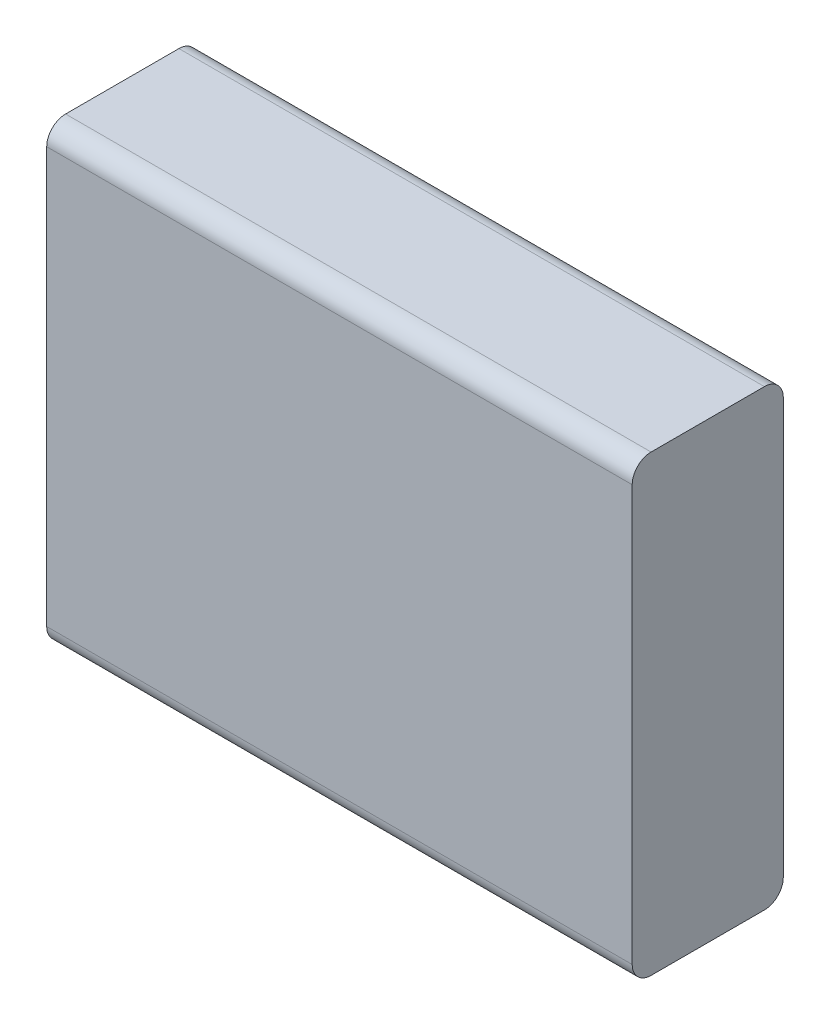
SolidWorks part; units mm, degrees
ref_plane "Plan de face" through (0, 0, 0) normal (0, 0, 1) x (1, 0, 0)
ref_plane "Plan de dessus" through (0, 0, 0) normal (0, 1, 0) x (1, 0, 0)
ref_plane "Plan de droite" through (0, 0, 0) normal (1, 0, 0) x (0, 0, -1)
sketch "Esquisse1" plane through (0, 0, 0) normal (0, 0, 1) x (1, 0, 0)
  line L1 (0, 0) -> (62, 0)
  line L2 (0, 0) -> (0, 48)
  line L3 (0, 48) -> (62, 48)
  line L4 (62, 0) -> (62, 48)
  dimension "D1" = 62
  dimension "D2" = 48
extrude "Boss.-Extru.1" add sketch "Esquisse1" along normal blind 16
fillet "Congé1" radius 2 4 edges at (31, 0, 0) (31, 0, 16) (31, 48, 0) (31, 48, 16)
sketch "Esquisse3" plane through (0, 0, 0) normal (0, 0, -1) x (-1, 0, 0)
  line L1 (-55, 39) -> (-59, 39)
  line L2 (-55, 39) -> (-55, 31)
  line L3 (-55, 31) -> (-59, 31)
  line L4 (-59, 39) -> (-59, 31)
  line L5 (-62, 48) -> (0, 48) construction
  line L6 (-62, 2) -> (-62, 46) construction
  dimension "D1" = 4
  dimension "D2" = 8
  dimension "D3" = 3
  dimension "D4" = 9
extrude "Enlèv. mat.-Extru.2" cut sketch "Esquisse3" against normal blind 2
sketch "Esquisse4" plane through (0, 0, 2) normal (0, 0, -1) x (-1, 0, 0)
  line L0 (-55, 39) -> (-59, 39) construction
  line L1 (-58.7, 38.7) -> (-55.3, 38.7)
  line L2 (-58.7, 38.7) -> (-58.7, 35.3)
  line L3 (-58.7, 35.3) -> (-55.3, 35.3)
  line L4 (-55.3, 38.7) -> (-55.3, 35.3)
  line L5 (-55, 31) -> (-55, 39) construction
  line L7 (-59, 39) -> (-59, 31) construction
  dimension "D1" = 0.3
  dimension "D2" = 0.3
  dimension "D3" = 0.3
  dimension "D4" = 3.4
extrude "Boss.-Extru.2" add sketch "Esquisse4" along normal blind 3.5
